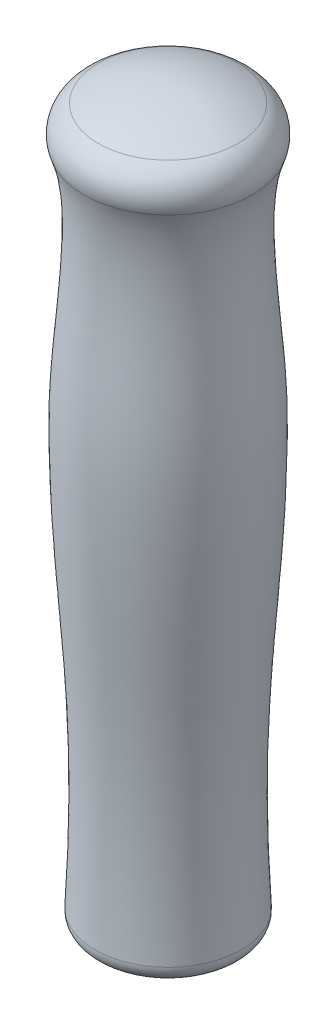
SolidWorks part; units mm, degrees
ref_plane "Front Plane" through (0, 0, 0) normal (0, 0, 1) x (1, 0, 0)
ref_plane "Top Plane" through (0, 0, 0) normal (0, 1, 0) x (1, 0, 0)
ref_plane "Right Plane" through (0, 0, 0) normal (1, 0, 0) x (0, 0, -1)
sketch "Sketch1" plane through (0, 0, 0) normal (0, 0, 1) x (1, 0, 0)
  line L0 (0, 0) -> (0, 137.2488) construction
  line L1 (-7.9375, 0) -> (7.9375, 0) construction
  line L2 (-7.9375, 0) -> (-7.9375, 115.8875) construction
  line L3 (-7.9375, 115.8875) -> (7.9375, 115.8875) construction
  line L4 (7.9375, 0) -> (7.9375, 115.8875) construction
  line L5 (7.9375, 0) -> (11.7475, 0)
  line L6 (13.4004, 79.8327) -> (13.4004, 50.9923) construction
  line L7 (0, 115.8875) -> (-8.8673, 115.8875) construction
  line L8 (7.9375, 0) -> (7.9375, 111.7052)
  line L9 (0, 113.2125) -> (0, 115.8875)
  arc A0 (7.9375, 111.7052) -> (0, 113.2125) centre (0, 91.5594) ccw
  arc A1 (15.1474, 110.5965) -> (0, 115.8875) centre (0, 91.5594) ccw
  spline S0 degree 3 poles (11.7475, 0) (9.9018, 30.0573) (13.131, 43.6565) (13.6027, 83.0189) (9.459, 103.2778) (15.1474, 110.5965) knots 0 0 0 0 0.584487 0.665002 1 1 1 1
  point P4 (0, 0)
  dimension "D1" = 15.875
  dimension "D2" = 115.8875
  dimension "D3" = 3.81
revolve "Revolve1" add sketch "Sketch1" angle 360 about L0
fillet "Fillet1" radius 2.54 1 edges at (0, 0, -11.7475)
fillet "Fillet2" radius 4.7625 1 edges at (0, 110.5965, -15.1474)
